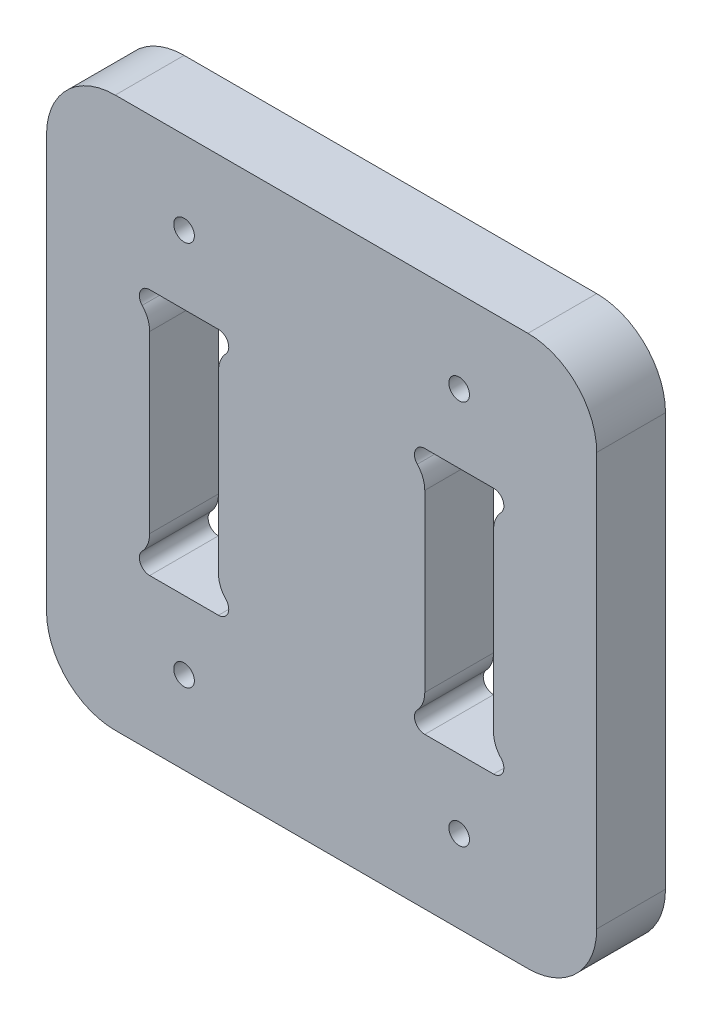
SolidWorks part; units mm, degrees
ref_plane "Plan de face" through (0, 0, 0) normal (0, 0, 1) x (1, 0, 0)
ref_plane "Plan de dessus" through (0, 0, 0) normal (0, 1, 0) x (1, 0, 0)
ref_plane "Plan de droite" through (0, 0, 0) normal (1, 0, 0) x (0, 0, -1)
sketch "Esquisse1" plane through (0, 0, 0) normal (0, 0, 1) x (1, 0, 0)
  line L8 (-15, -18) -> (-25, -18)
  line L9 (-25, -12.7251) -> (-25, 12.7251)
  line L10 (-25, 18) -> (-15, 18)
  line L11 (-15, 12.7251) -> (-15, -12.7251)
  line L12 (0, -55) -> (0, 55) construction
  line L13 (15, 12.7251) -> (15, -12.7251)
  line L14 (25, 18) -> (15, 18)
  line L15 (25, -12.7251) -> (25, 12.7251)
  line L16 (15, -18) -> (25, -18)
  line L18 (-30, 40) -> (30, 40)
  line L19 (-40, 30) -> (-40, -30)
  line L20 (-30, -40) -> (30, -40)
  line L21 (40, 30) -> (40, -30)
  arc A12 (-15, -12.7251) -> (-13.9091, -15.4705) centre (-11, -12.7251) ccw
  arc A13 (-15, -18) -> (-13.9091, -15.4705) centre (-15, -16.5) ccw
  arc A14 (-26.0909, -15.4705) -> (-25, -18) centre (-25, -16.5) ccw
  arc A15 (-26.0909, -15.4705) -> (-25, -12.7251) centre (-29, -12.7251) ccw
  arc A16 (-25, 12.7251) -> (-26.0909, 15.4705) centre (-29, 12.7251) ccw
  arc A17 (-25, 18) -> (-26.0909, 15.4705) centre (-25, 16.5) ccw
  arc A18 (-13.9091, 15.4705) -> (-15, 18) centre (-15, 16.5) ccw
  arc A19 (-13.9091, 15.4705) -> (-15, 12.7251) centre (-11, 12.7251) ccw
  circle A20 centre (-20, 28) radius 1.5
  circle A22 centre (-20, -28) radius 1.5
  circle A23 centre (20, -28) radius 1.5
  circle A24 centre (20, 28) radius 1.5
  arc A25 (13.9091, 15.4705) -> (15, 12.7251) centre (11, 12.7251) cw
  arc A26 (13.9091, 15.4705) -> (15, 18) centre (15, 16.5) cw
  arc A27 (25, 18) -> (26.0909, 15.4705) centre (25, 16.5) cw
  arc A28 (25, 12.7251) -> (26.0909, 15.4705) centre (29, 12.7251) cw
  arc A29 (26.0909, -15.4705) -> (25, -12.7251) centre (29, -12.7251) cw
  arc A30 (26.0909, -15.4705) -> (25, -18) centre (25, -16.5) cw
  arc A31 (15, -18) -> (13.9091, -15.4705) centre (15, -16.5) cw
  arc A32 (15, -12.7251) -> (13.9091, -15.4705) centre (11, -12.7251) cw
  arc A33 (30, -40) -> (40, -30) centre (30, -30) ccw
  arc A34 (30, 40) -> (40, 30) centre (30, 30) cw
  arc A35 (-30, 40) -> (-40, 30) centre (-30, 30) ccw
  arc A36 (-40, -30) -> (-30, -40) centre (-30, -30) ccw
  point P62 (-40, 40)
  point P65 (-40, -40)
  dimension "D9" = 4
  dimension "D10" = 4
  dimension "D11" = 4
  dimension "D12" = 4
  dimension "D13" = 1.5
  dimension "D14" = 1.5
  dimension "D15" = 1.5
  dimension "D16" = 1.5
  dimension "D19" = 3
  dimension "D20" = 3
  dimension "D24" = 10
  dimension "D2" = 10
  dimension "D3" = 80
  dimension "D4" = 15
  dimension "D5" = 5
  dimension "D6" = 5
  dimension "D7" = 10
  dimension "D8" = 10
  dimension "D17" = 36
  dimension "D18" = 18
  dimension "D21" = 80
  dimension "D22" = 40
  dimension "D23" = 40
extrude "Boss.-Extru.1" add sketch "Esquisse1" along normal blind 10
